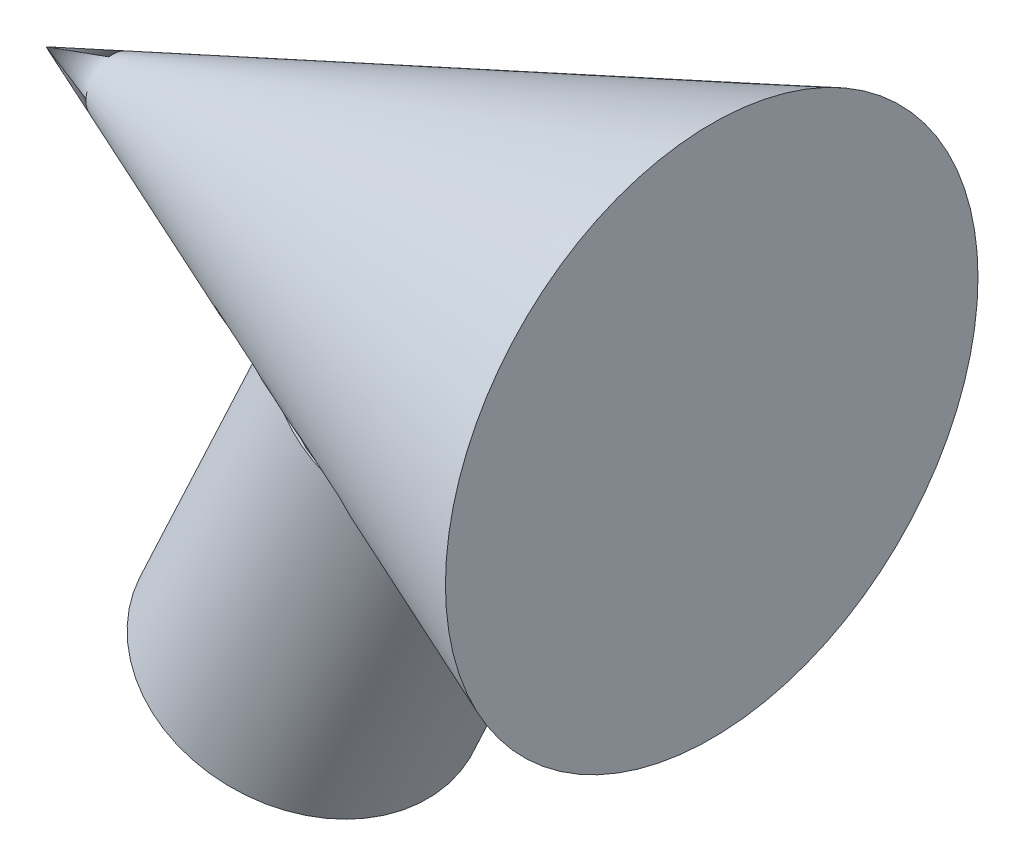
SolidWorks part; units mm, degrees
ref_plane "前视基准面" through (0, 0, 0) normal (0, 0, 1) x (1, 0, 0)
ref_plane "上视基准面" through (0, 0, 0) normal (0, 1, 0) x (1, 0, 0)
ref_plane "右视基准面" through (0, 0, 0) normal (1, 0, 0) x (0, 0, -1)
sketch "草图1" plane through (0, 0, 0) normal (0, 0, 1) x (1, 0, 0)
  line L0 (-68.1691, 0) -> (70.4103, 0) construction
  line L1 (-56.2162, 0) -> (-6.2162, 20)
  line L2 (-6.2162, 20) -> (-6.2162, 0)
  line L3 (-56.2162, 0) -> (-6.2162, 0)
  dimension "D1" = 20
  dimension "D2" = 50
revolve "旋转1" add sketch "草图1" angle 360 about L0
sketch "草图2" plane through (0, 0, 0) normal (0, 0, 1) x (1, 0, 0)
  line L0 (-25.6202, -6.7633) -> (-37.1686, -31.529) construction
  line L1 (-34.8382, -2.8693) -> (-45.6913, -26.1439)
  line L3 (-45.6913, -26.1439) -> (-36.6282, -30.37)
  line L4 (-36.6282, -30.37) -> (-25.1081, -5.6651)
  line L5 (-25.1081, -5.6651) -> (-34.8382, -2.8693)
  dimension "D1" = 10
revolve "旋转2" add sketch "草图2" angle 360 about L0
